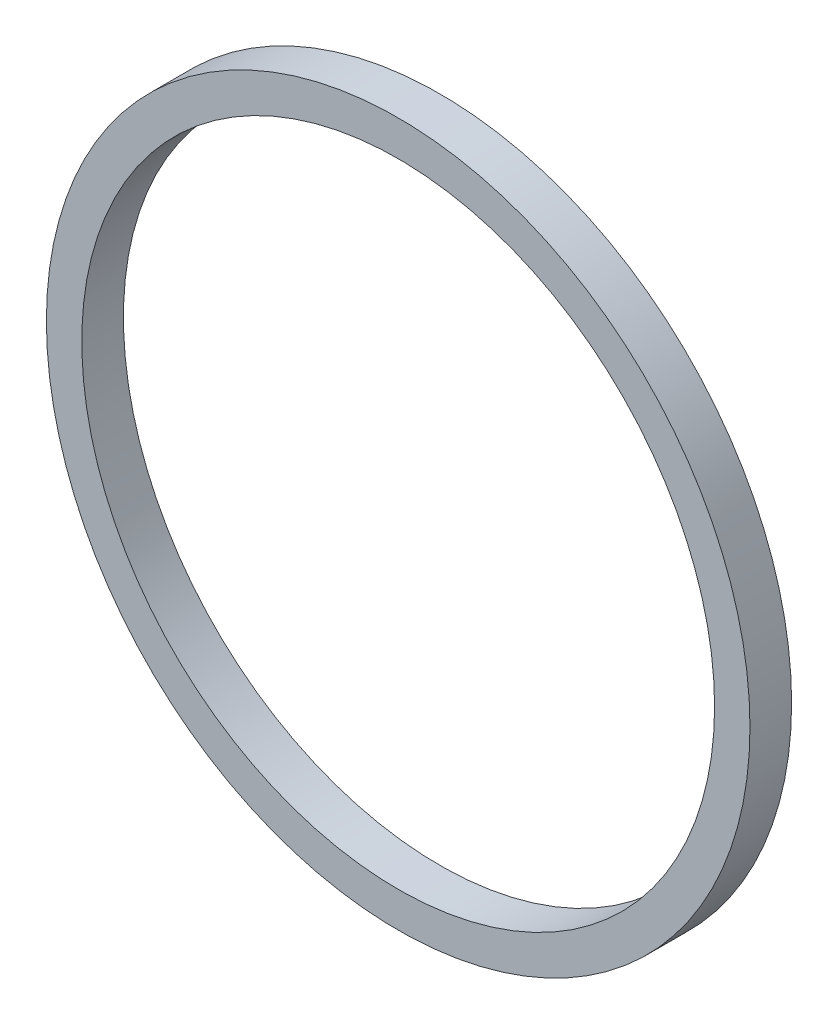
SolidWorks part; units mm, degrees
ref_plane "Front" through (0, 0, 0) normal (0, 0, 1) x (1, 0, 0)
ref_plane "Top" through (0, 0, 0) normal (0, 1, 0) x (1, 0, 0)
ref_plane "Right" through (0, 0, 0) normal (1, 0, 0) x (0, 0, -1)
sketch "Sketch1" plane through (0, 0, 0) normal (0, 0, 1) x (1, 0, 0)
  circle A0 centre (0, 0) radius 9.652
  circle A1 centre (0, 0) radius 10.7315
  dimension "D1" = 21.463
  dimension "D2" = 19.304
extrude "Extrude1" add sketch "Sketch1" along normal blind 1.27
